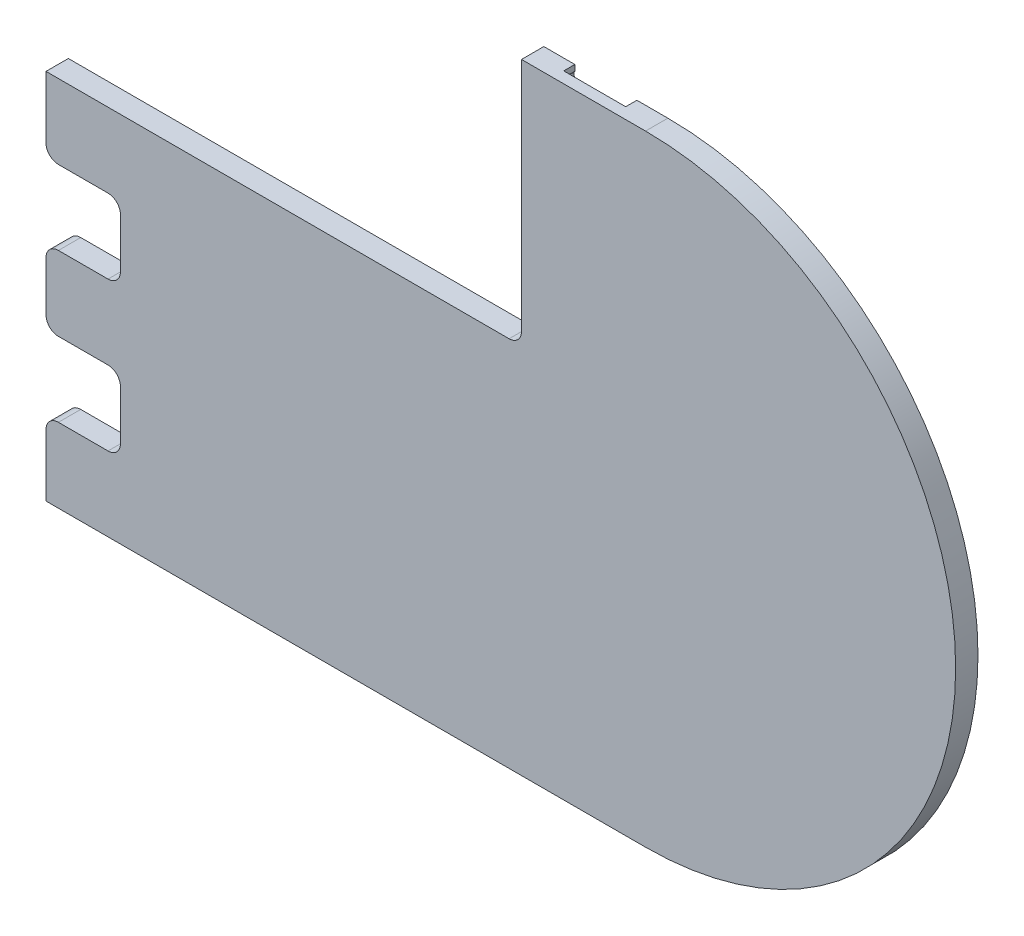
SolidWorks part; units mm, degrees
ref_plane "Plan de face" through (0, 0, 0) normal (0, 0, 1) x (1, 0, 0)
ref_plane "Plan de dessus" through (0, 0, 0) normal (0, 1, 0) x (1, 0, 0)
ref_plane "Plan de droite" through (0, 0, 0) normal (1, 0, 0) x (0, 0, -1)
sketch "Esquisse1" plane through (0, 0, 0) normal (0, 0, 1) x (1, 0, 0)
  line L1 (-850, -250) -> (850, -250)
  line L3 (-850, 250) -> (850, 250)
  arc A0 (-850, 250) -> (-850, -250) centre (-850, 0) ccw
  arc A1 (850, -250) -> (850, 250) centre (850, 0) ccw
  point P0 (0, 0)
  dimension "D3" = 500
  dimension "D5" = 500
extrude "Boss.-Extru.1" add sketch "Esquisse1" along normal blind 18
sketch "Esquisse2" plane through (0, 0, 18) normal (0, 0, 1) x (1, 0, 0)
  line L0 (850, 250) -> (750, 250) construction
  line L1 (850, 250) -> (-850, 250) construction
  line L2 (-850, 250) -> (-750, 250) construction
  line L3 (-750, 250) -> (-750, 50)
  line L4 (-750, 50) -> (750, 50)
  line L5 (750, 50) -> (750, 250)
  dimension "D1" = 100
  dimension "D2" = 100
  dimension "D3" = 200
extrude "Enlèv. mat.-Extru.1" cut sketch "Esquisse2" against normal blind 18 and the other way through all
sketch "Esquisse4" plane through (0, 0, 0) normal (0, 0, -1) x (-1, 0, 0)
  line L0 (-366.6667, -250) -> (-366.6667, 272.5751) construction
  line L1 (850, -250) -> (-850, -250) construction
  line L2 (366.6633, -250) -> (366.6633, 272.5751) construction
  dimension "D2" = 733.33
sketch "Esquisse5" plane through (0, 0, 0) normal (0, 0, -1) x (-1, 0, 0)
  line L0 (-366.6667, 50) -> (-366.6667, -10)
  line L1 (-366.6667, -250) -> (-366.6667, 272.5751) construction
  line L2 (750, 50) -> (-750, 50) construction
  line L3 (-366.6667, -10) -> (-426.6667, -10)
  line L4 (-426.6667, -10) -> (-426.6667, -70)
  line L5 (-426.6667, -70) -> (-366.6667, -70)
  line L6 (-366.6667, -70) -> (-366.6667, -130)
  line L7 (-366.6667, -130) -> (-426.6667, -130)
  line L8 (-426.6667, -130) -> (-426.6667, -190)
  line L9 (-426.6667, -190) -> (-366.6667, -190)
  line L10 (-366.6667, -190) -> (-366.6667, -250)
  line L12 (0, 50) -> (0, -445.9359) construction
  line L13 (366.6667, -190) -> (366.6667, -250)
  line L14 (426.6667, -190) -> (366.6667, -190)
  line L15 (426.6667, -130) -> (426.6667, -190)
  line L16 (366.6667, -130) -> (426.6667, -130)
  line L17 (366.6667, -70) -> (366.6667, -130)
  line L18 (426.6667, -70) -> (366.6667, -70)
  line L19 (426.6667, -10) -> (426.6667, -70)
  line L20 (366.6667, -10) -> (426.6667, -10)
  line L21 (366.6667, 50) -> (366.6667, -10)
  line L22 (-366.6667, 50) -> (-750, 50)
  line L23 (-750, 50) -> (-750, 250)
  line L24 (-750, 250) -> (-850, 250)
  line L25 (-850, -250) -> (-366.6667, -250)
  line L26 (-366.6667, 50) -> (366.6667, 50)
  line L27 (-366.6667, -250) -> (366.6667, -250)
  line L28 (-366.6667, 50) -> (366.6667, 50)
  line L29 (-366.6667, -250) -> (366.6667, -250)
  arc A1 (-850, 250) -> (-850, -250) centre (-850, 0) ccw
  dimension "D1" = 60
extrude "Enlèv. mat.-Extru.2" cut sketch "Esquisse5" against normal blind 30 contours L12 L0 L3 L4 L5 L6 L7 L8 L9 L10 M11 M15 | L12 L13 L14 L15 L16 L17 L18 L19 L20 L21 M11 M15 | L21 L20 L19 L18 L17 L16 L15 L14 L13 M11 M15 M16 M17 M18
fillet "Congé3" radius 10 8 edges at (366.6667, -190, 9) (426.6667, -190, 9) (366.6667, -130, 9) (426.6667, -130, 9) (426.6667, -70, 9) (366.6667, -70, 9) (366.6667, -10, 9) (426.6667, -10, 9)
sketch "Esquisse7" plane through (0, 0, 0) normal (0, 0, -1) x (-1, 0, 0)
  line L0 (-396.6667, -10) -> (-396.6667, 50) construction
  line L1 (-376.6667, -10) -> (-416.6667, -10) construction
  line L2 (-366.6667, 50) -> (-750, 50) construction
  line L3 (-403.5453, 29.8787) -> (-405.6667, 29.8787) construction
  line L8 (-401.424, 8) -> (-391.9093, 8)
  line L9 (-405.6667, 12.2426) -> (-405.6667, 27.7574)
  line L12 (-387.6667, 12.2426) -> (-387.6667, 27.7574)
  line L13 (-405.6667, 8) -> (-387.6667, 32) construction
  line L14 (-405.6667, 32) -> (-387.6667, 8) construction
  line L15 (-403.5453, 29.8787) -> (-403.5453, 32) construction
  line L16 (-401.424, 32) -> (-391.9093, 32)
  arc A4 (-401.424, 32) -> (-405.6667, 27.7574) centre (-403.5453, 29.8787) ccw
  arc A5 (-391.9093, 8) -> (-387.6667, 12.2426) centre (-389.788, 10.1213) ccw
  arc A6 (-401.424, 8) -> (-405.6667, 12.2426) centre (-403.5453, 10.1213) cw
  arc A7 (-391.9093, 32) -> (-387.6667, 27.7574) centre (-389.788, 29.8787) cw
  point P6 (-396.6667, 20)
  point P21 (-396.6667, 20)
  dimension "D3" = 6
  dimension "D1" = 18
  dimension "D2" = 24
  dimension "D4" = 2
extrude "Enlèv. mat.-Extru.4" cut sketch "Esquisse7" against normal blind 9
pattern_linear "Répétition linéaire2" count 3 spacing 120 along (0, -1, 0) of "Enlèv. mat.-Extru.4"
fillet "Congé1" radius 10 1 edges at (750, 50, 9)
sketch "Esquisse9" plane through (0, 0, 0) normal (0, 0, -1) x (-1, 0, 0)
  line L0 (-850, 250) -> (-750, 250) construction
  line L1 (-825, 259) -> (-775, 259)
  line L2 (-825, 259) -> (-825, 245.2426)
  line L3 (-820.7574, 241) -> (-779.2426, 241)
  line L4 (-775, 259) -> (-775, 245.2426)
  line L5 (-825, 259) -> (-780.108, 242.8389) construction
  line L6 (-819.892, 242.8389) -> (-775, 259) construction
  line L7 (-822.8787, 243.1213) -> (-825, 243.1213) construction
  line L8 (-825, 243.1213) -> (-822.8787, 243.1213) construction
  line L9 (-822.8787, 243.1213) -> (-822.8787, 241) construction
  line L10 (-777.1213, 243.1213) -> (-777.1213, 241) construction
  line L11 (-777.1213, 243.1213) -> (-775, 243.1213) construction
  arc A0 (-825, 245.2426) -> (-820.7574, 241) centre (-822.8787, 243.1213) ccw
  arc A1 (-779.2426, 241) -> (-775, 245.2426) centre (-777.1213, 243.1213) ccw
  point P0 (-800, 250)
  dimension "D3" = 6
  dimension "D4" = 6
  dimension "D2" = 50
extrude "Enlèv. mat.-Extru.5" cut sketch "Esquisse9" against normal blind 9
sketch "Esquisse10" plane through (0, 0, 0) normal (0, 0, -1) x (-1, 0, 0)
  line L0 (-850, -250) -> (-750, -250) construction
  line L1 (-366.6667, -250) -> (-850, -250) construction
  line L3 (-825, -232) -> (-775, -232)
  line L4 (-825, -232) -> (-825, -268)
  line L5 (-825, -268) -> (-775, -268)
  line L6 (-775, -232) -> (-775, -268)
  line L7 (-825, -232) -> (-775, -268) construction
  line L8 (-825, -268) -> (-775, -232) construction
  point P5 (-800, -250)
  dimension "D1" = 100
  dimension "D2" = 50
  dimension "D3" = 36
extrude "Enlèv. mat.-Extru.6" cut sketch "Esquisse10" against normal blind 9
sketch "Esquisse11" plane through (0, 0, 0) normal (0, 0, -1) x (-1, 0, 0)
  line L0 (-849.2538, 0) -> (-1129.3144, 0) construction
  arc A0 (-1090.0366, -16) -> (-1090.0366, 16) centre (-957.656, 0) cw construction
  arc A1 (-1098.9716, 17.0799) -> (-1098.9716, -17.0799) centre (-957.656, 0) ccw
  arc A6 (-1081.1016, 14.9201) -> (-1081.1016, -14.9201) centre (-957.656, 0) ccw
  arc A8 (-1081.1016, 14.9201) -> (-1098.9716, 17.0799) centre (-1090.0366, 16) ccw
  arc A9 (-1098.9716, -17.0799) -> (-1081.1016, -14.9201) centre (-1090.0366, -16) ccw
  arc A10 (-850, 250) -> (-850, -250) centre (-850, 0) ccw construction
  point P3 (-1091, 0)
  point P11 (-1100, 0)
  point P12 (0, 0)
  dimension "D1" = 32
  dimension "D2" = 9
  dimension "D3" = 241
